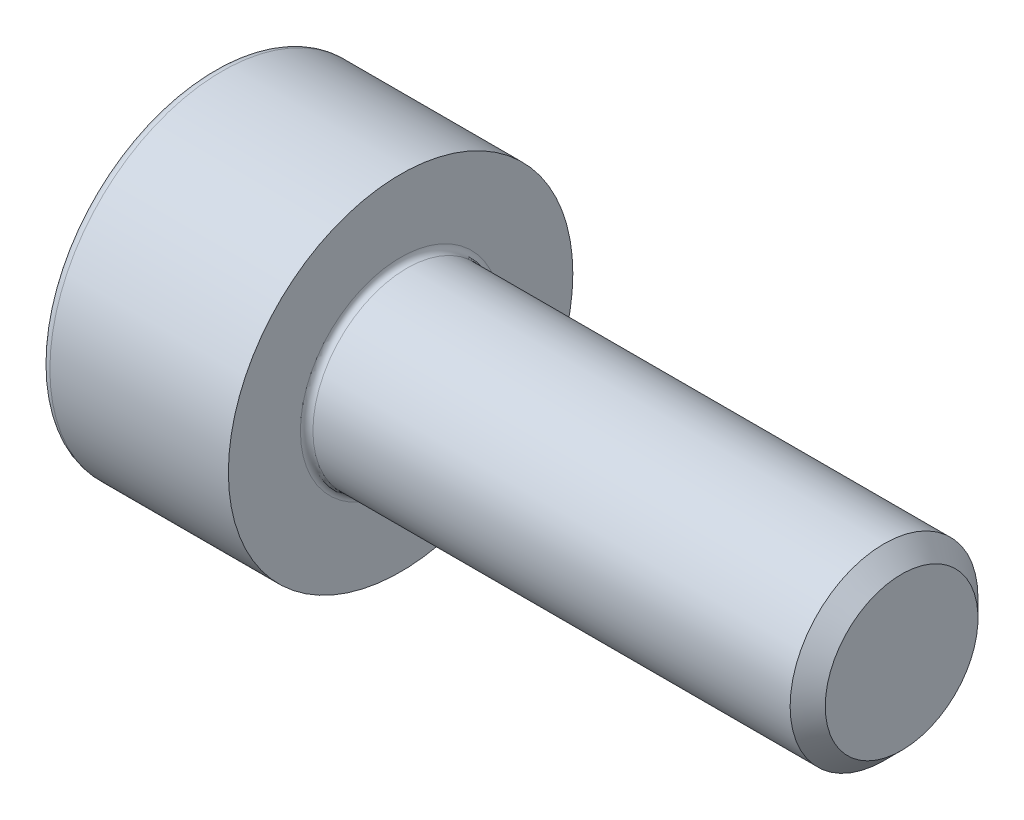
SolidWorks part; units mm, degrees
revolve "Base-Revolve" add sketch "BodySke"
sketch "BodySke" plane through (0, 0, 0) normal (0, 0, 1) x (1, 0, 0)
  line L0 (0, 0) -> (0, 2.75)
  line L1 (0, 2.75) -> (3, 2.75)
  line L2 (3, 2.75) -> (3, 1.5)
  line L3 (3, 1.5) -> (10.7195, 1.5)
  line L4 (11, 1.2195) -> (11, 0)
  line L5 (11, 0) -> (0, 0)
  line L6 (-31.75, 0) -> (127, 0) construction
  line L8 (11, 1.2195) -> (10.7195, 1.5)
  line L10 (11, -1.2195) -> (10.7195, -1.5) construction
  line L11 (3.5, 9.525) -> (3.5, 3.175) construction
  line L12 (3, 9.525) -> (3, 3.175) construction
  line L13 (-49, 9.525) -> (-49, 3.175) construction
fillet "Fillet1" radius 0.1 1 edges at (3, 0, 1.5)
fillet "Fillet2" radius 0.15 1 edges at (0, 0, 2.75)
ref_plane "Plane1" through (0, 0, 0) normal (0, 0, 1) x (1, 0, 0)
ref_plane "Plane2" through (0, 0, 0) normal (0, 1, 0) x (1, 0, 0)
ref_plane "Plane3" through (0, 0, 0) normal (1, 0, 0) x (0, 0, -1)
sketch "Sketch2" plane through (0, 0, 0) normal (0, 0, 1) x (1, 0, 0)
  line L0 (0, 1.28) -> (1.3, 1.28)
  line L1 (1.3, 1.28) -> (2.039, 0)
  line L2 (-31.75, 0) -> (127, 0) construction
  line L3 (2.039, 0) -> (0, 0)
  line L4 (0, 0) -> (0, 1.28)
  line L6 (0, 0) -> (47.625, 0) construction
revolve "Hex-PreBroach" cut sketch "Sketch2" angle 360 about L6
sketch "Sketch3" plane through (0, 0, 0) normal (-1, 0, 0) x (0, 0.5, 0.866)
  line L0 (0.739, 1.28) -> (-0.739, 1.28)
  line L1 (-0.739, 1.28) -> (-1.478, 0)
  line L2 (0.739, 1.28) -> (1.478, 0)
  line L3 (0.739, -1.28) -> (1.478, 0)
  line L4 (0.739, -1.28) -> (-0.739, -1.28)
  line L5 (-0.739, -1.28) -> (-1.478, 0)
extrude "Hex" cut sketch "Sketch3" against normal blind 1.3
sketch "ThdSchSke" plane through (0, 0, 0) normal (0, 0, 1) x (1, 0, 0)
  line L0 (4.5, -1.2195) -> (4.3036, -1.5)
  line L1 (4.5, -1.2195) -> (4.6964, -1.5)
  line L2 (4.6964, -1.5) -> (4.6964, -1.875)
  line L3 (-3.175, 0) -> (5.1513, 0) construction
  line L4 (0, 2.6) -> (0, -2.6) construction
  line L5 (4.6964, -1.875) -> (4.3036, -1.875)
  line L6 (4.3036, -1.875) -> (4.3036, -1.5)
revolve "ThreadSchematic" [suppressed] cut sketch "ThdSchSke" angle 360 about L3
pattern_linear "ThdSchPat" [suppressed]
equation "\"D2@Sketch3\" = \"Hex_size@Sketch3\" / 2"
equation "\"D1@Sketch3\" = \"Hex_size@Sketch3\" / 2"
equation "\"D1@Sketch2\" = \"Hex_size@Sketch3\" / 2"
equation "\"Thread_minor@ThreadCosmetic\"  =  \"Minor_dia@BodySke\""
equation "\"Depth@Sketch2\" =  \"Key_eng@Hex\""
equation "\"Thread_length@ThreadCosmetic\" = ((sgn( (\"Length@BodySke\" - \"Advance@BodySke\" * 3.0) - \"Thread_nom@BodySke\" )-1)*( (\"Length@BodySke\" - \"Advance@BodySke\" * 3.0) - \"Thread_nom@BodySke\" ))/-2+ \"Thread_no"
equation "\"Thread_minor@ThdSchSke\" = \"Minor_dia@BodySke\""
equation "\"Diameter@ThdSchSke\" = \"Diameter@BodySke\""
equation "\"Overcut@ThdSchSke\" = \"Diameter@BodySke\" * 1.25"
equation "\"Start@ThdSchSke\" = \"Head_ht@BodySke\" + \"Length@BodySke\" - \"Thread_length@ThreadCosmetic\"  '---Non-countersunk---"
equation "\"Num_threads@ThdSchPat\" = int( \"Thread_length@ThreadCosmetic\" / \"Advance@BodySke\" + 0.999 )  + 1"
equation "\"Advance@ThdSchPat\" = \"Thread_length@ThreadCosmetic\" /  (\"Num_threads@ThdSchPat\" - 1) 'relax it"
equation "\"Num_threads@ThdSchPat\" = \"Num_threads@ThdSchPat\" - sgn( \"Num_threads@ThdSchPat\" - 1) '---chamfered tips only---"
